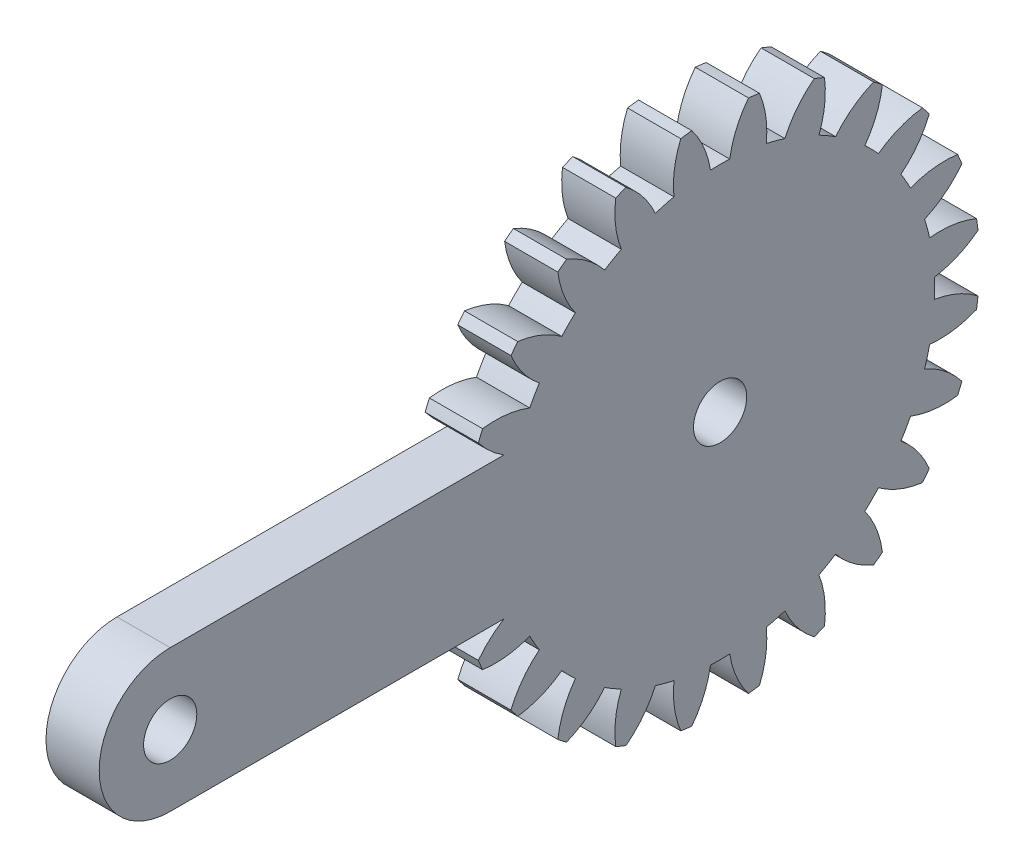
SolidWorks part; units mm, degrees
ref_plane "Front Plane" through (0, 0, 0) normal (0, 0, 1) x (1, 0, 0)
ref_plane "Top Plane" through (0, 0, 0) normal (0, 1, 0) x (1, 0, 0)
ref_plane "Right Plane" through (0, 0, 0) normal (1, 0, 0) x (0, 0, -1)
imported_body "spur gear_iso-2-solid1"
hole_wizard "Ø3.0 (3) Diameter Hole1" positions "Sketch2" profile "Sketch3" hole size "Ø3.0" standard "ISO"
sketch "Sketch2" plane through (3, 0, 0) normal (1, 0, 0) x (0, 0, -1)
  point P0 (0, 0)
sketch "Sketch3" plane through (3, 0, 0) normal (0, 1, 0) x (0, 0, -1)
  line L0 (0, 0) -> (0, 3)
  line L1 (0, 3) -> (1.5, 3)
  line L2 (1.5, 3) -> (1.5, 0)
  line L5 (1.5, 0) -> (0, 0)
  line L11 (0, -6.35) -> (0, 107.95) construction
  dimension "Thru Hole Dia." = 3
  dimension "Thru Hole Depth" = 3
sketch "Sketch4" plane through (3, 0, 0) normal (1, 0, 0) x (0, 0, -1)
  line L0 (0, 0) -> (-31, 0) construction
  line L1 (0, -4) -> (-31, -4)
  line L2 (0, 4) -> (-31, 4)
  arc A0 (0, -4) -> (0, 4) centre (0, 0) ccw
  arc A1 (-31, 4) -> (-31, -4) centre (-31, 0) ccw
  circle A2 centre (-31, 0) radius 1.5
  point P3 (-15.5, 0)
  dimension "D3" = 3
  dimension "D1" = 8
  dimension "D2" = 31
extrude "Boss-Extrude1" add sketch "Sketch4" against normal blind 3
hole_wizard "Ø3.0 (3) Diameter Hole2" positions "Sketch5" profile "Sketch6" hole size "Ø3.0" standard "ISO"
sketch "Sketch5" plane through (3, 0, 0) normal (1, 0, 0) x (0, 0, -1)
  point P0 (0, 0)
sketch "Sketch6" plane through (3, 0, 0) normal (0, 1, 0) x (0, 0, -1)
  line L0 (0, 0) -> (0, 3)
  line L1 (0, 3) -> (1.5, 3)
  line L2 (1.5, 3) -> (1.5, 0)
  line L5 (1.5, 0) -> (0, 0)
  line L11 (0, -6.35) -> (0, 107.95) construction
  dimension "Thru Hole Dia." = 3
  dimension "Thru Hole Depth" = 3
